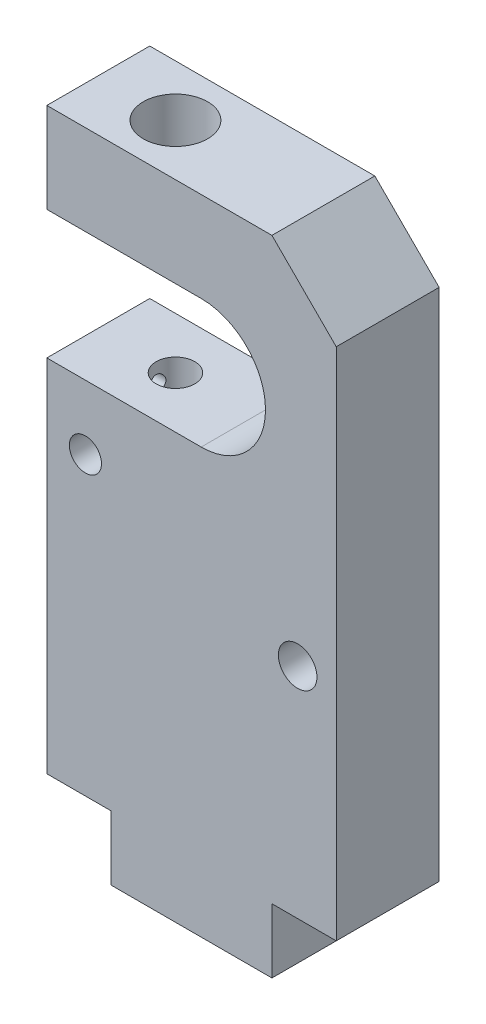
SolidWorks part; units mm, degrees
ref_plane "Frontal" through (0, 0, 0) normal (0, 0, 1) x (1, 0, 0)
ref_plane "Horizontal" through (0, 0, 0) normal (0, 1, 0) x (1, 0, 0)
ref_plane "Vertical" through (0, 0, 0) normal (1, 0, 0) x (0, 0, -1)
sketch "Esquisse1" plane through (0, 0, 0) normal (0, 0, 1) x (1, 0, 0)
  line L0 (12.5, 0) -> (12.5, 10)
  line L1 (12.5, 10) -> (22.5, 10)
  line L2 (22.5, 10) -> (22.5, 90)
  line L3 (22.5, 90) -> (12.5, 100)
  line L4 (12.5, 100) -> (-22.5, 100)
  line L5 (-22.5, 100) -> (-22.5, 86)
  line L6 (-22.5, 86) -> (1.5, 86)
  line L7 (1.5, 66) -> (-22.5, 66)
  line L8 (-22.5, 66) -> (-22.5, 10)
  line L9 (-22.5, 10) -> (-12.5, 10)
  line L10 (-12.5, 10) -> (-12.5, 0)
  line L11 (-12.5, 0) -> (12.5, 0)
  line L12 (0, -7.7492) -> (0, 142.0518) construction
  arc A0 (1.5, 86) -> (1.5, 66) centre (1.5, 76) cw
  circle A1 centre (16.5, 44) radius 3
  circle A2 centre (-16.5, 56) radius 2.5
  dimension "D9" = 6
  dimension "D13" = 5
  dimension "D1" = 45
  dimension "D2" = 25
  dimension "D3" = 10
  dimension "D4" = 100
  dimension "D5" = 10
  dimension "D6" = 45
  dimension "D7" = 66
  dimension "D8" = 20
  dimension "D10" = 44
  dimension "D11" = 39
  dimension "D12" = 24
  dimension "D14" = 6
  dimension "D15" = 56
extrude "Extrusion1" add sketch "Esquisse1" along normal mid plane 16
hole_wizard "Trou taraudé M61" positions "Esquisse3" profile "Esquisse2" tap size "M6" standard "ISO"
sketch "Esquisse3" plane through (0, 0, 0) normal (0, -1, 0) x (1, 0, 0)
  point P0 (0, 0)
sketch "Esquisse2" plane through (0, 0, 0) normal (1, 0, 0) x (0, 0, -1)
  line L0 (0, 0) -> (0, 21.5022)
  line L1 (0, 21.5022) -> (2.5, 20)
  line L2 (2.5, 20) -> (2.5, 0)
  line L5 (2.5, 0) -> (0, 0)
  line L10 (0, 21.5022) -> (-2.5, 20) construction
  line L11 (0, -6.35) -> (0, 107.95) construction
  dimension "Diamètre du trou pour taraudage" = 5
  dimension "Profondeur du trou pour taraudage" = 20
  dimension "Angle de pointe" = 118
hole_wizard "Trou taraudé M31" positions "Esquisse5" profile "Esquisse4" tap size "M3" standard "ISO"
sketch "Esquisse5" plane through (-22.5, 0, 0) normal (-1, 0, 0) x (0, 0, 1)
  line L0 (0, -8.5335) -> (0, 105.4273) construction
  line L1 (8, 0) -> (-8, 0) construction
  point P0 (0, 63)
  dimension "D1" = 63
sketch "Esquisse4" plane through (-22.5, 63, 0) normal (0, 1, 0) x (0, 0, 1)
  line L0 (0, 0) -> (0, 14.2511)
  line L1 (0, 14.2511) -> (1.25, 13.5)
  line L2 (1.25, 13.5) -> (1.25, 0)
  line L5 (1.25, 0) -> (0, 0)
  line L10 (0, 14.2511) -> (-1.25, 13.5) construction
  line L11 (0, -6.35) -> (0, 107.95) construction
  dimension "Diamètre du trou pour taraudage" = 2.5
  dimension "Profondeur du trou pour taraudage" = 13.5
  dimension "Angle de pointe" = 118
hole_wizard "Diamètre du perçage Ø10.0 (10)1" positions "Esquisse7" profile "Esquisse6" hole size "Ø10.0" standard "ISO"
sketch "Esquisse7" plane through (0, 100, 0) normal (0, 1, 0) x (-1, 0, 0)
  line L0 (-9.3161, 0) -> (23.3578, 0) construction
  line L1 (22.5, 8) -> (22.5, -8) construction
  point P0 (10.5, 0)
  dimension "D1" = 12
sketch "Esquisse6" plane through (-10.5, 100, 0) normal (1, 0, 0) x (0, 0, 1)
  line L0 (0, 0) -> (0, 14)
  line L1 (0, 14) -> (5, 14)
  line L2 (5, 14) -> (5, 0)
  line L5 (5, 0) -> (0, 0)
  line L11 (0, -6.35) -> (0, 107.95) construction
  dimension "Diamètre du perçage jusqu'au prochain" = 10
  dimension "Profondeur du perçage jusqu'au prochain" = 14
hole_wizard "Perçage1" positions "Esquisse9" profile "Esquisse8" legacy
sketch "Esquisse9" plane through (0, 66, 0) normal (0, 1, 0) x (-1, 0, 0)
  line L0 (28.5803, 0) -> (-29.1635, 0) construction
  point P0 (10.5, 0)
sketch "Esquisse8" plane through (-10.5, 66, 0) normal (1, 0, 0) x (0, 0, 1)
  line L0 (0, 0) -> (0, 31.2017)
  line L1 (0, 31.2017) -> (2, 30)
  line L2 (2, 30) -> (2, 6)
  line L3 (2, 6) -> (3, 6)
  line L4 (3, 0) -> (0, 0)
  line L5 (0, -11.3109) -> (0, 121.1557) construction
  line L6 (0, 31.2017) -> (-2, 30) construction
  line L7 (3, 6) -> (3, 0)
  dimension "Diamètre" = 4
  dimension "Profondeur" = 30
  dimension "Diamètre chambrage" = 6
  dimension "Profondeur chambrage" = 6
  dimension "Angle" = 118
sketch "Esquisse10" plane through (-22.5, 0, 0) normal (-1, 0, 0) x (0, 0, 1)
  line L0 (0, -7.757) -> (0, 59.9983) construction
  line L1 (8, 0) -> (-8, 0) construction
  point P3 (0, 24)
  dimension "D1" = 24
ref_plane "Plan1" through (-1.2949, -2.2428, 0) normal (-0.5, -0.866, 0) x (0.866, -0.5, 0)
sketch "Esquisse11" plane through (-1.2949, -2.2428, 0) normal (-0.5, -0.866, 0) x (0.866, -0.5, 0)
  circle A0 centre (-31.4856, 0) radius 2
  dimension "D1" = 4
extrude "Extrusion2" cut sketch "Esquisse11" against normal up to next
